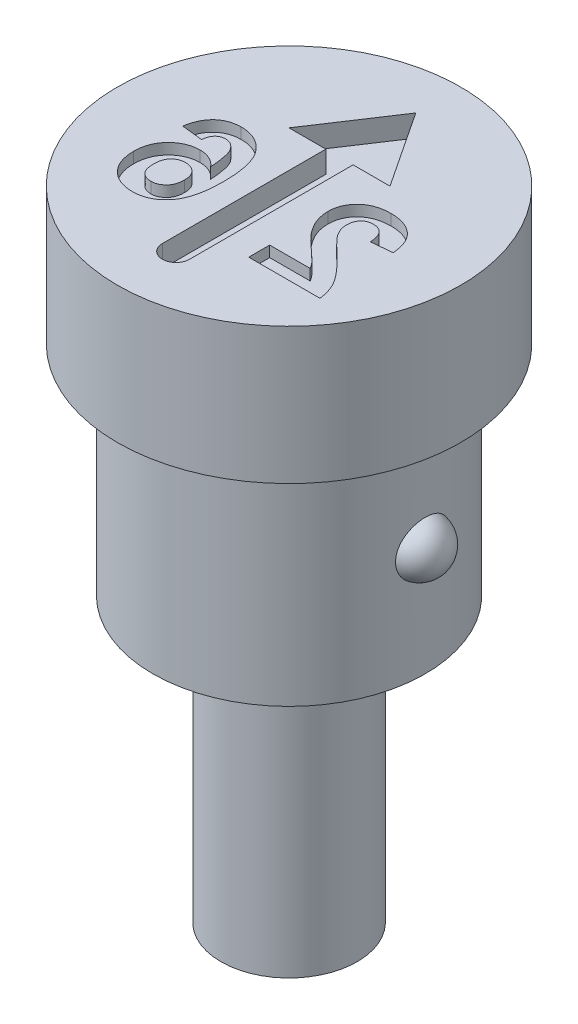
SolidWorks part; units mm, degrees
ref_plane "Front Plane" through (0, 0, 0) normal (0, 0, 1) x (1, 0, 0)
ref_plane "Top Plane" through (0, 0, 0) normal (0, 1, 0) x (1, 0, 0)
ref_plane "Right Plane" through (0, 0, 0) normal (1, 0, 0) x (0, 0, -1)
sketch "Sketch1" plane through (0, 0, 0) normal (0, 0, 1) x (1, 0, 0)
  line L0 (0, 0) -> (0, -11.7) construction
  line L1 (0, -3.465) -> (0, 3.465) construction
  line L2 (0, 0) -> (-3.15, 0)
  line L3 (-3.15, 0) -> (-3.15, -2.5)
  line L4 (-3.15, -2.5) -> (-2.5, -2.5)
  line L5 (-2.5, -2.5) -> (-2.5, -6.5)
  line L6 (-2.5, -6.5) -> (-1.25, -6.5)
  line L7 (-1.25, -6.5) -> (-1.25, -11.7)
  line L8 (-1.25, -11.7) -> (0, -11.7)
  line L9 (0, -11.7) -> (0, 0)
  dimension "D1" = 6.3
  dimension "D2" = 11.7
  dimension "D3" = 2.5
  dimension "D4" = 6.5
  dimension "D5" = 5
  dimension "D6" = 2.5
revolve "Revolve1" add sketch "Sketch1" angle 360 about L0
sketch "Sketch3" plane through (0, 0, 0) normal (0, 1, 0) x (1, 0, 0)
  line L0 (0, 2.325) -> (-0.9266, 0.925)
  line L1 (-0.9266, 0.925) -> (-0.25, 0.925)
  line L2 (-0.25, 0.925) -> (-0.25, -2.075)
  line L3 (0.25, -2.075) -> (0.25, 0.925)
  line L4 (0.25, 0.925) -> (0.9266, 0.925)
  line L5 (0.9266, 0.925) -> (0, 2.325)
  line L6 (0, 2.325) -> (0, -2.325) construction
  arc A0 (-0.25, -2.075) -> (0.25, -2.075) centre (0, -2.075) ccw
  dimension "D3" = 0.25
  dimension "D1" = 1.4
  dimension "D2" = 67
  dimension "D4" = 4.4
extrude "Cut-Extrude1" cut sketch "Sketch3" against normal blind 0.4
sketch "Sketch4" plane through (0, 0, 0) normal (0, 1, 0) x (1, 0, 0)
  text T0 "26" font "Arial" height 2
extrude "Cut-Extrude2" cut sketch "Sketch4" against normal blind 0.2
sketch "Sketch5" plane through (0, 0, 0) normal (0, 0, 1) x (1, 0, 0)
  line L2 (2.3885, -4) -> (2.3885, -5)
  line L3 (2.3885, -4) -> (2.3885, -5) construction
  line L4 (-2.5, -4.5) -> (2.3885, -4.5) construction
  line L5 (-2.5, -2.5) -> (-2.5, -6.5) construction
  arc A1 (2.3885, -5) -> (2.3885, -4) centre (2.3885, -4.5) ccw
  dimension "D1" = 0.5
revolve "Revolve2" add sketch "Sketch5" angle 360 about L2
